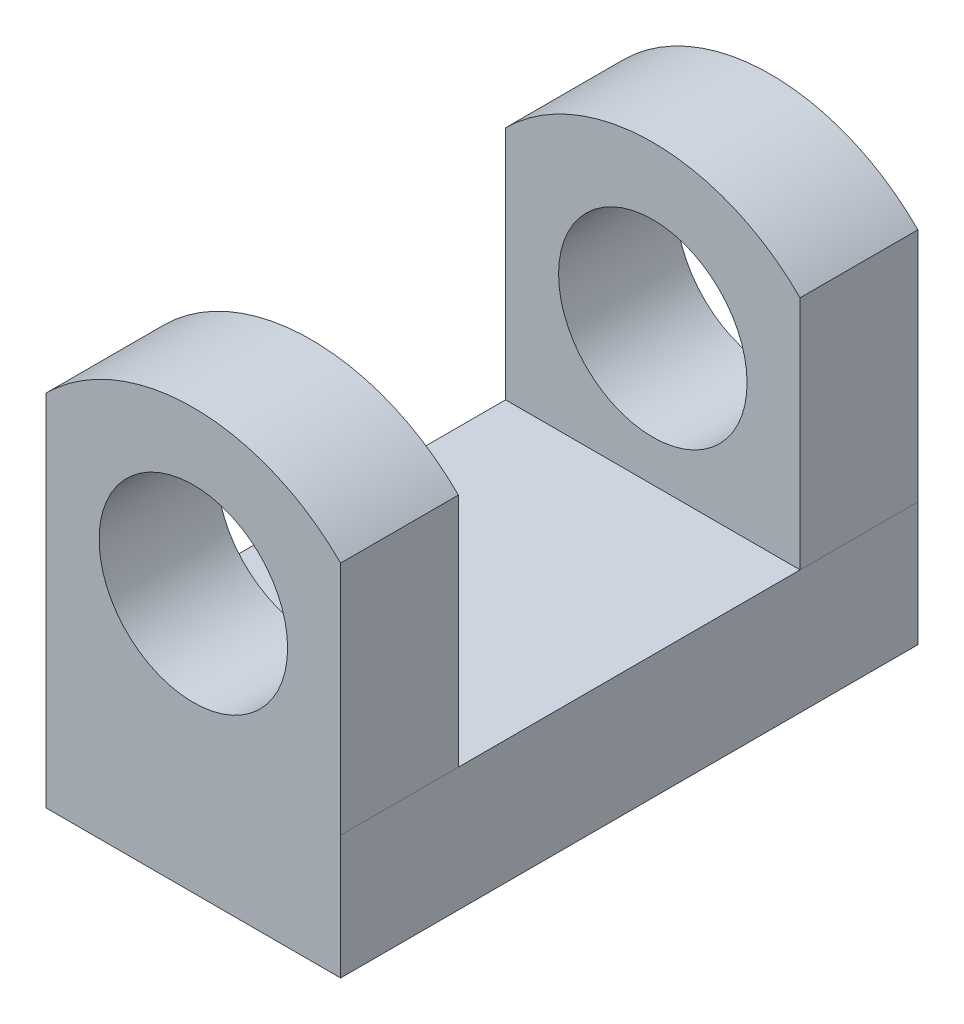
SolidWorks part; units mm, degrees
ref_plane "Front Plane" through (0, 0, 0) normal (0, 0, 1) x (1, 0, 0)
ref_plane "Top Plane" through (0, 0, 0) normal (0, 1, 0) x (1, 0, 0)
ref_plane "Right Plane" through (0, 0, 0) normal (1, 0, 0) x (0, 0, -1)
sketch "Sketch2" plane through (0, 0, 0) normal (0, 1, 0) x (1, 0, 0)
  line L1 (-6.35, 12.446) -> (6.35, 12.446)
  line L2 (-6.35, 12.446) -> (-6.35, -12.446)
  line L3 (-6.35, -12.446) -> (6.35, -12.446)
  line L4 (6.35, 12.446) -> (6.35, -12.446)
  line L5 (-6.35, 12.446) -> (6.35, -12.446) construction
  line L6 (-6.35, -12.446) -> (6.35, 12.446) construction
  point P0 (0, 0)
  dimension "D1" = 24.892
  dimension "D2" = 12.7
extrude "Boss-Extrude1" add sketch "Sketch2" along normal blind 0.254 and the other way blind 5.08
sketch "Sketch4" plane through (6.35, 0, 0) normal (1, 0, 0) x (0, 0, -1)
  line L0 (-12.446, 0.254) -> (-12.446, 18.034)
  line L1 (-12.446, 18.034) -> (-7.366, 18.034)
  line L2 (-7.366, 18.034) -> (-7.366, 0.254)
  line L3 (-12.446, 0.254) -> (12.446, 0.254) construction
  line L4 (-7.366, 0.254) -> (-12.446, 0.254)
  dimension "D1" = 5.08
  dimension "D2" = 17.78
extrude "Boss-Extrude2" add sketch "Sketch4" along normal through all and the other way through all
sketch "Sketch6" plane through (0, 0, 0) normal (1, 0, 0) x (0, 0, -1)
  line L0 (12.446, 0.254) -> (12.446, 18.034)
  line L1 (12.446, 18.034) -> (7.366, 18.034)
  line L2 (7.366, 18.034) -> (7.366, 0.254)
  line L3 (-7.366, 0.254) -> (12.446, 0.254) construction
  line L4 (7.366, 0.254) -> (12.446, 0.254)
  dimension "D1" = 17.78
  dimension "D2" = 5.08
extrude "Boss-Extrude3" add sketch "Sketch6" along normal through all and the other way through all
sketch "Sketch7" plane through (0, 0, -12.446) normal (0, 0, -1) x (-1, 0, 0)
  circle A0 centre (0, 6.096) radius 4.064
  dimension "D2" = 8.128
extrude "Cut-Extrude1" cut sketch "Sketch7" against normal through all
sketch "Sketch8" plane through (0, 0, -12.446) normal (0, 0, -1) x (-1, 0, 0)
  line L0 (-6.3503, 0.254) -> (-6.3503, 18.034) construction
  line L1 (6.35, 0.254) -> (6.35, 18.034) construction
  line L3 (-6.3503, 10.414) -> (-6.3503, 18.034)
  line L4 (-6.3503, 18.034) -> (6.35, 18.034) construction
  line L5 (-6.3503, 18.034) -> (6.35, 18.034)
  line L6 (6.35, 18.034) -> (6.35, 10.414)
  arc A0 (-6.3503, 10.414) -> (6.35, 10.414) centre (-0.0001, 4.0638) cw
  dimension "D1" = 7.62
  dimension "D2" = 7.62
extrude "Cut-Extrude2" cut sketch "Sketch8" against normal through all
